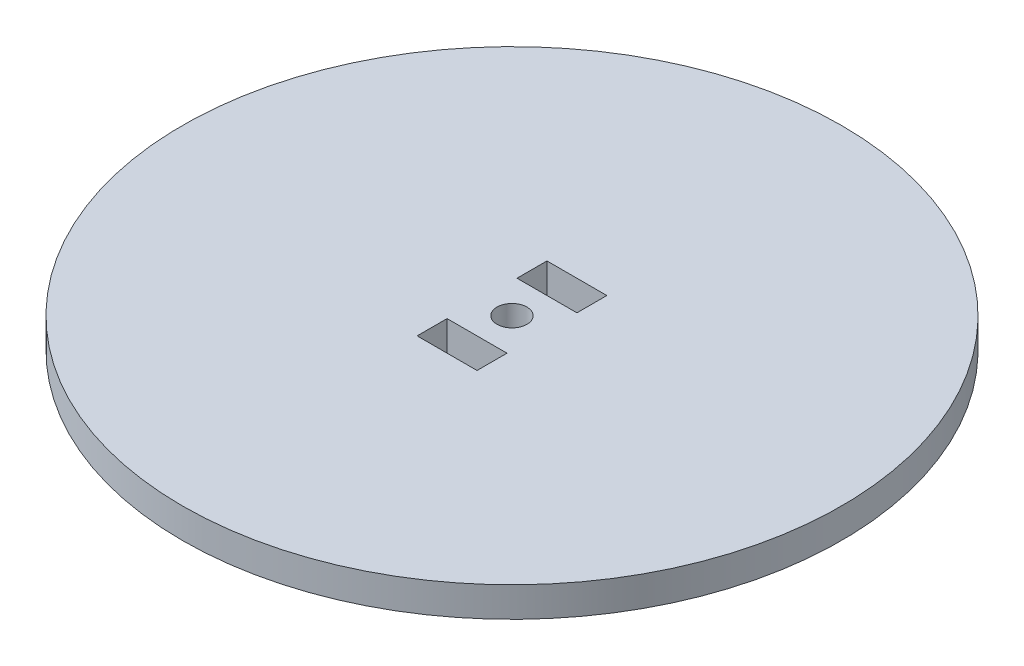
SolidWorks part; units mm, degrees
ref_plane "Front" through (0, 0, 0) normal (0, 0, 1) x (1, 0, 0)
ref_plane "Top" through (0, 0, 0) normal (0, 1, 0) x (1, 0, 0)
ref_plane "Right" through (0, 0, 0) normal (1, 0, 0) x (0, 0, -1)
sketch "草图1" plane through (0, 0, 0) normal (0, 1, 0) x (1, 0, 0)
  circle A0 centre (0, 0) radius 33
  circle A1 centre (0, 0) radius 1.5
  dimension "D1" = 66
  dimension "D2" = 3
extrude "凸台-拉伸1" add sketch "草图1" along normal blind 3
sketch "草图2" plane through (0, 3, 0) normal (0, 1, 0) x (1, 0, 0)
  line L1 (-3, -6.5) -> (3, -6.5)
  line L2 (-3, -6.5) -> (-3, -3.5)
  line L5 (3, -3.5) -> (3, -6.5)
  line L7 (3, 3.5) -> (3, 6.5)
  line L8 (3, 6.5) -> (-3, 6.5)
  line L9 (-3, 6.5) -> (-3, 3.5)
  line L14 (-3, -3.5) -> (3, -3.5)
  line L15 (-3, 3.5) -> (3, 3.5)
  circle A2 centre (0, 0) radius 1.5 construction
  point P6 (0, -6.5)
  dimension "D1" = 3.5
  dimension "D5" = 3.5
  dimension "D2" = 6
  dimension "D3" = 3
  dimension "D4" = 3
  dimension "D6" = 6
extrude "切除-拉伸1" cut sketch "草图2" against normal blind 5
